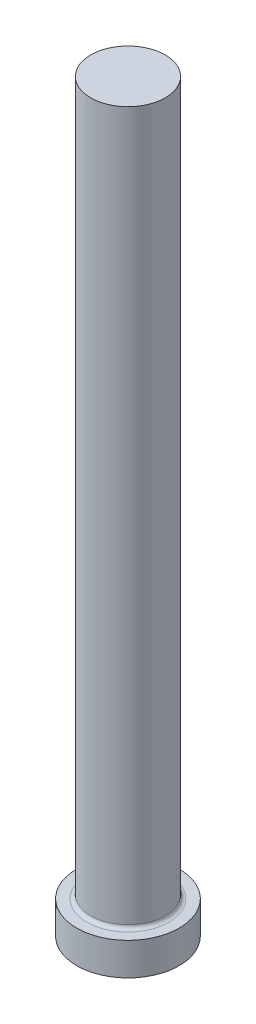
SolidWorks part; units mm, degrees
ref_plane "Plano frontal" through (0, 0, 0) normal (0, 0, 1) x (1, 0, 0)
ref_plane "Plano superior" through (0, 0, 0) normal (0, 1, 0) x (1, 0, 0)
ref_plane "Plano direito" through (0, 0, 0) normal (1, 0, 0) x (0, 0, -1)
sketch "Esboço1" plane through (0, 0, 0) normal (0, 0, 1) x (1, 0, 0)
  line L0 (0, 0) -> (11, 0)
  line L1 (11, 0) -> (11, 7)
  line L2 (11, 7) -> (8.8, 7)
  line L3 (8, 7.8) -> (8, 160)
  line L4 (8, 160) -> (0, 160)
  line L5 (0, 160) -> (0, 0) construction
  line L6 (0, 0) -> (0, 160)
  arc A0 (8.8, 7) -> (8, 7.8) centre (8.8, 7.8) cw
  dimension "D3" = 0.8
  dimension "D1" = 22
  dimension "D2" = 16
  dimension "D4" = 7
  dimension "D5" = 160
revolve "Revolução1" add sketch "Esboço1" angle 360 about L5
sketch "Esboço2"
  dimension "D1" = 0.825
  dimension "D2" = 1.925
  dimension "D3" = 1.2375
  dimension "D4" = 5.9125
wrap "Envolver1" sketch "Esboço2" wrap type deboss source sketch "Esboço2" thickness 0.1 parameters "D1"=0.1
